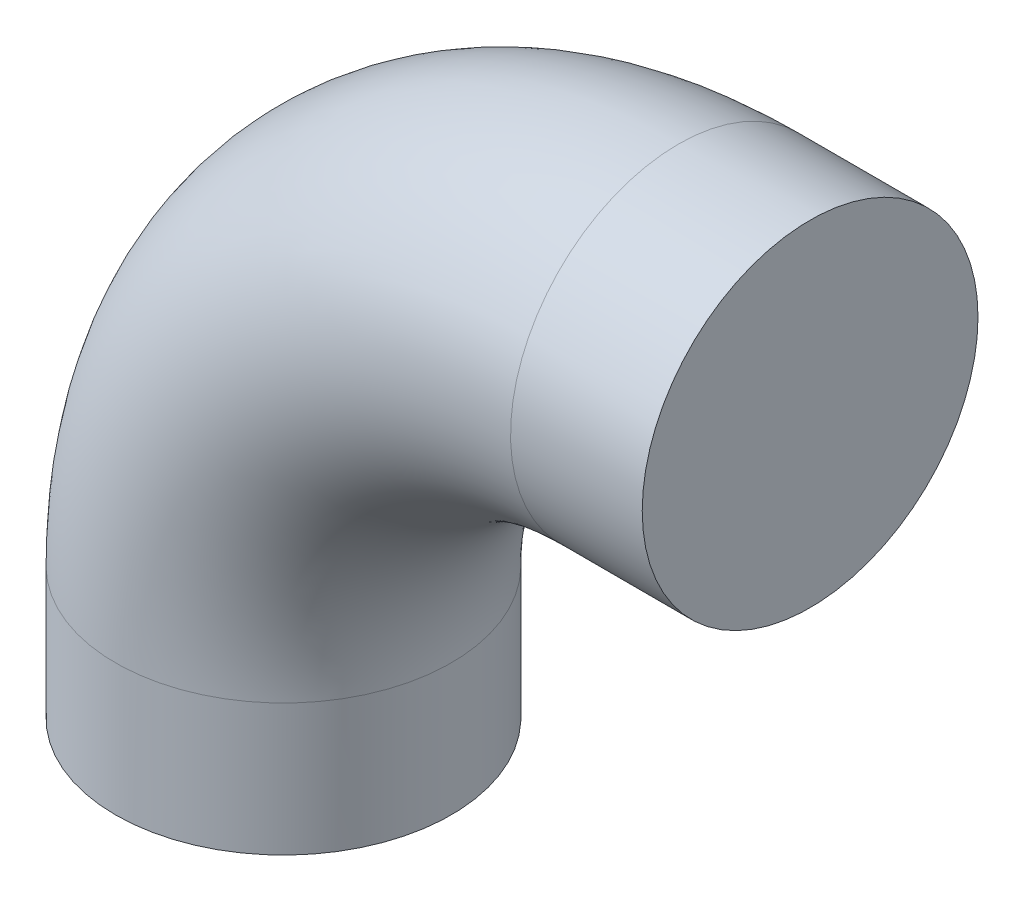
SolidWorks part; units mm, degrees
ref_plane "Front Plane" through (0, 0, 0) normal (0, 0, 1) x (1, 0, 0)
ref_plane "Top Plane" through (0, 0, 0) normal (0, 1, 0) x (1, 0, 0)
ref_plane "Right Plane" through (0, 0, 0) normal (1, 0, 0) x (0, 0, -1)
sketch "Sketch1" plane through (0, 0, 0) normal (0, 0, 1) x (1, 0, 0)
  line L0 (0, 0) -> (-0.508, 0)
  line L1 (-2.032, -1.524) -> (-2.032, -2.032)
  arc A0 (-0.508, 0) -> (-2.032, -1.524) centre (-0.508, -1.524) ccw
  dimension "D1" = 1.524
sketch "Sketch2" plane through (0, 0, 0) normal (1, 0, 0) x (0, 0, -1)
  circle A0 centre (0, 0) radius 0.6477
sweep "Sweep1" add profiles "Sketch2" path "Sketch1"
